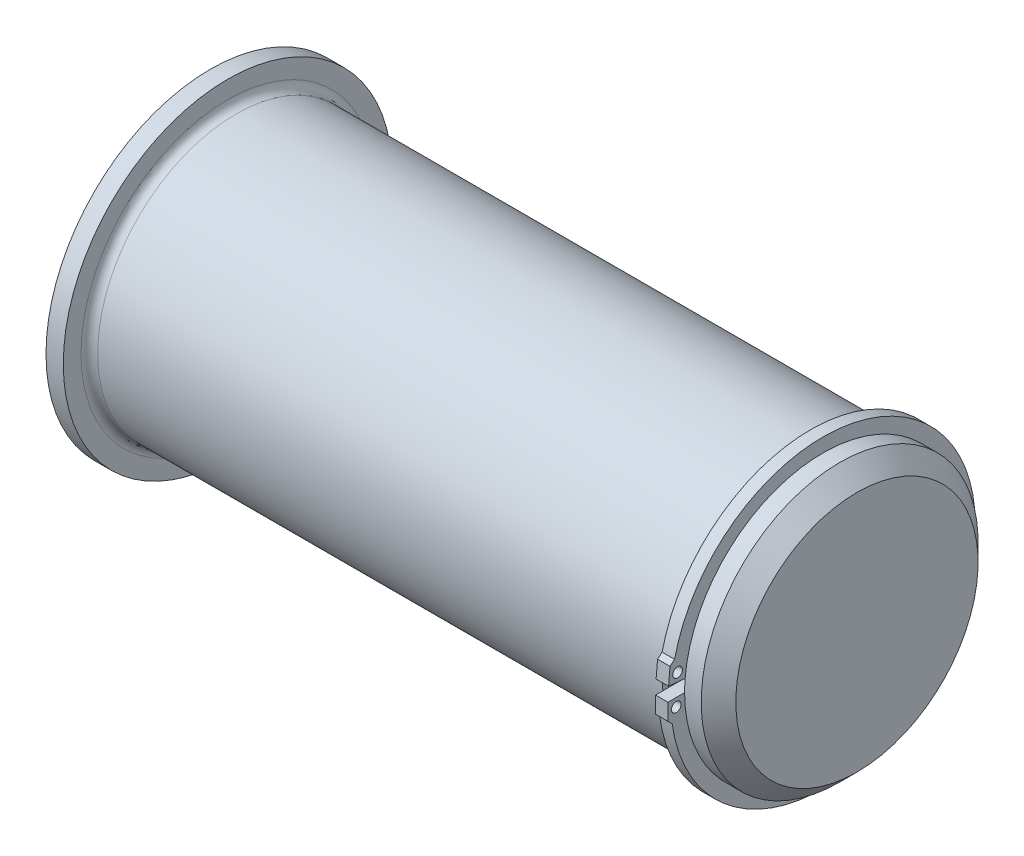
SolidWorks part; units mm, degrees
ref_plane "Front Plane" through (0, 0, 0) normal (0, 0, 1) x (1, 0, 0)
ref_plane "Top Plane" through (0, 0, 0) normal (0, 1, 0) x (1, 0, 0)
ref_plane "Right Plane" through (0, 0, 0) normal (1, 0, 0) x (0, 0, -1)
sketch "Sketch3" plane through (0, 0, 0) normal (0, 0, 1) x (1, 0, 0)
  line L0 (0, 0) -> (55.9435, 0)
  line L1 (0, 0) -> (0, 12.7) construction
  line L2 (0, 12.7) -> (50.8, 12.7)
  line L3 (50.8, 12.7) -> (50.8, 11.049)
  line L4 (50.8, 11.049) -> (52.832, 11.049)
  line L5 (52.832, 11.049) -> (52.832, 12.7)
  line L6 (52.832, 12.7) -> (54.356, 12.7)
  line L7 (54.356, 12.7) -> (55.9435, 11.1125)
  line L8 (55.9435, 11.1125) -> (55.9435, 0)
  line L9 (0, 12.7) -> (-1.016, 12.7)
  line L10 (-1.778, 13.462) -> (-1.778, 15.0876)
  line L11 (-1.778, 15.0876) -> (-3.3655, 15.0876)
  line L12 (-3.3655, 15.0876) -> (-3.3655, 0)
  line L13 (-3.3655, 0) -> (0, 0)
  arc A0 (-1.016, 12.7) -> (-1.778, 13.462) centre (-1.016, 13.462) cw
  point P13 (51.816, 11.049)
  point P17 (-1.778, 12.7)
  dimension "D7" = 0.762
  dimension "D1" = 12.7
  dimension "D2" = 50.8
  dimension "D3" = 11.049
  dimension "D4" = 15.0876
  dimension "D5" = 1.5875
  dimension "D6" = 1.778
  dimension "D8" = 2.032
  dimension "D9" = 1.524
  dimension "D10" = 1.5875
  dimension "D11" = 135
revolve "Revolve1" add sketch "Sketch3" angle 360 about L0
sketch "Sketch5" plane through (52.832, 0, 0) normal (-1, 0, 0) x (0, 0, 1)
  line L0 (11.007, 0.963) -> (14.1699, 1.2397)
  line L1 (14.1699, 1.2397) -> (14.037, 2.7579)
  line L2 (14.037, 2.7579) -> (13.6199, 3.1079)
  line L3 (11.049, 0) -> (14.224, 0)
  line L4 (14.224, 0) -> (14.224, -1.524)
  line L5 (14.224, -1.524) -> (13.8389, -1.9091)
  line L6 (11.007, 0.963) -> (0, 0) construction
  line L7 (0, 0) -> (11.049, 0) construction
  line L8 (14.1035, 1.9988) -> (13.3444, 1.9324) construction
  line L9 (14.224, -0.762) -> (13.462, -0.762) construction
  arc A0 (11.007, 0.963) -> (11.049, 0) centre (0, 0) ccw
  arc A1 (13.6199, 3.1079) -> (13.8389, -1.9091) centre (0, 0) ccw
  circle A2 centre (0, 0) radius 11.049 construction
  circle A4 centre (13.3444, 1.9324) radius 0.4445
  circle A5 centre (13.462, -0.762) radius 0.4445
  dimension "D2" = 13.97
  dimension "D8" = 0.889
  dimension "D3" = 3.175
  dimension "D4" = 1.524
  dimension "D5" = 5
  dimension "D6" = 135
  dimension "D7" = 135
  dimension "D9" = 0.762
extrude "Boss-Extrude1" add sketch "Sketch5" along normal blind 1.143
